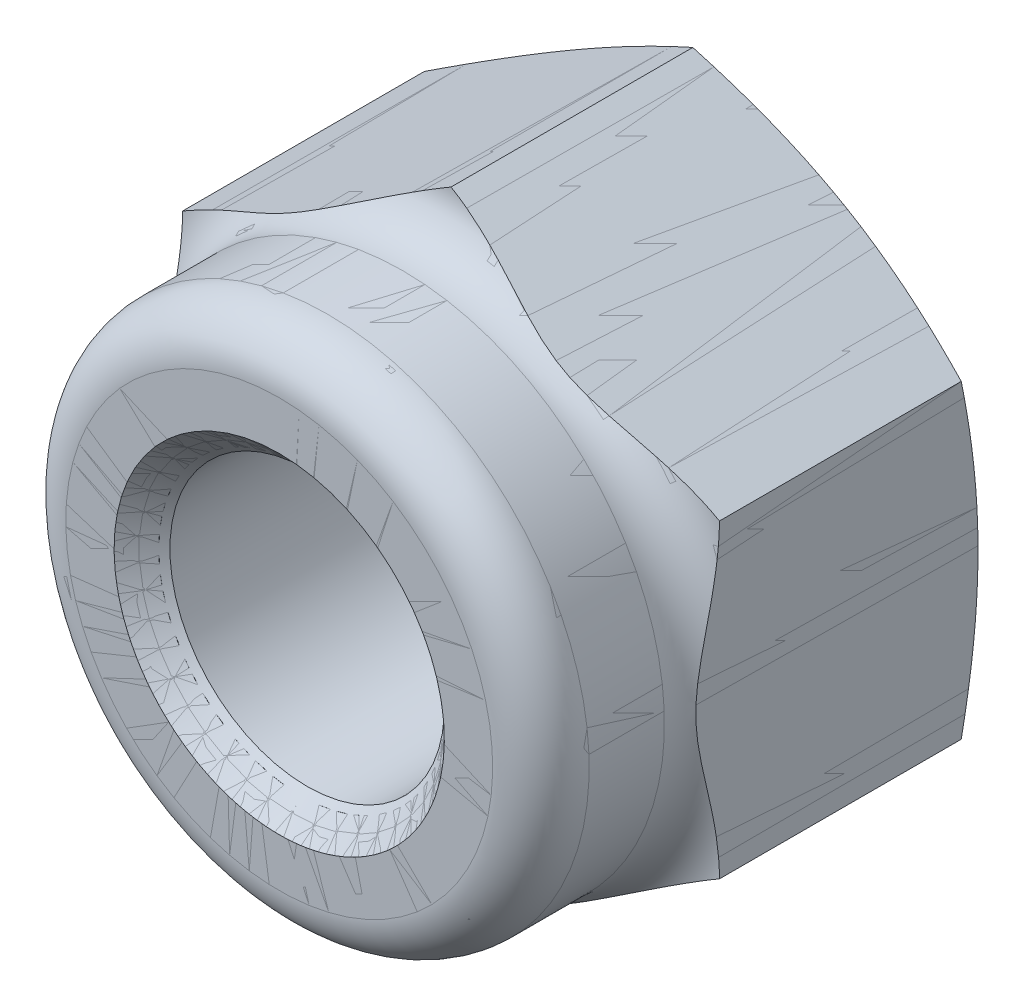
SolidWorks part; units mm, degrees
ref_plane "face" through (0, 0, 0) normal (0, 0, 1) x (1, 0, 0)
ref_plane "dessus" through (0, 0, 0) normal (0, 1, 0) x (1, 0, 0)
ref_plane "profil" through (0, 0, 0) normal (1, 0, 0) x (0, 0, -1)
imported_body "Importée1"
sketch "Esquisse1" plane through (0, 0, 10.6) normal (0, 0, 1) x (1, 0, 0)
  circle A0 centre (0, 0) radius 3.46
  dimension "D1" = 6.92
extrude "Enlèv. mat.-Extru.1" cut sketch "Esquisse1" against normal through all
sketch "Esq_WRNL_Compact001" plane through (0, 0, 0) normal (0, 0, 1) x (1, 0, 0)
  line L0 (-8.5056, -9.0287) -> (-8.5056, 9.0287)
  line L1 (8.5056, -9.0287) -> (8.5056, 9.0287)
  line L2 (-8.5056, -9.0287) -> (8.5056, -9.0287)
  line L3 (-8.5056, 9.0287) -> (8.5056, 9.0287)
